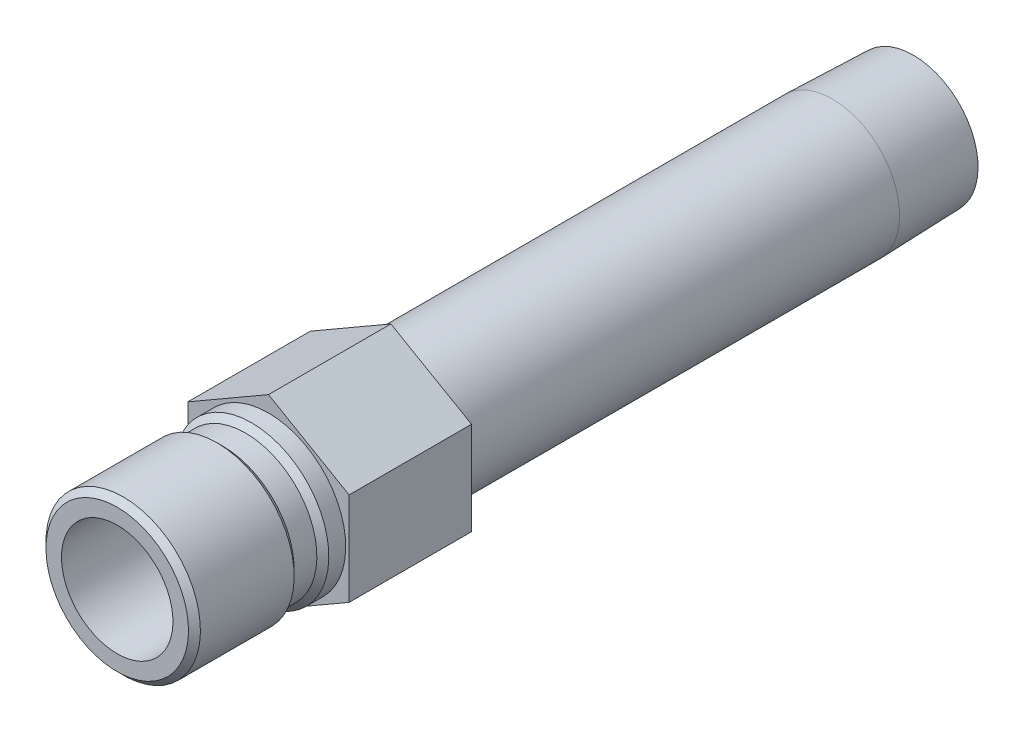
SolidWorks part; units mm, degrees
ref_plane "Front Plane" through (0, 0, 0) normal (0, 0, 1) x (1, 0, 0)
ref_plane "Top Plane" through (0, 0, 0) normal (0, 1, 0) x (1, 0, 0)
ref_plane "Right Plane" through (0, 0, 0) normal (1, 0, 0) x (0, 0, -1)
sketch "Sketch1" plane through (0, 0, 0) normal (1, 0, 0) x (0, 0, -1)
  line L0 (0, 0) -> (-22.479, 0) construction
  line L1 (-19.304, 7.112) -> (-19.304, 9.0932)
  line L2 (-5.8166, 9.0932) -> (-5.8166, 0) construction
  line L3 (-18.542, 9.8552) -> (-6.5786, 9.8552)
  line L4 (0, 8.5725) -> (0, 0) construction
  line L5 (-5.8166, 9.0932) -> (-2.921, 9.0932)
  line L6 (-2.159, 9.8552) -> (0, 9.8552)
  line L7 (0, 9.8552) -> (0, 8.5725)
  line L8 (-5.8166, 9.0932) -> (-6.5786, 9.8552)
  line L9 (-2.921, 9.0932) -> (-2.159, 9.8552)
  line L10 (-19.304, 9.0932) -> (-18.542, 9.8552)
  line L11 (-19.304, 7.112) -> (-1.524, 7.112)
  line L12 (0, 8.5725) -> (71.9582, 8.5725)
  line L13 (71.9582, 8.5725) -> (82.296, 8.2494)
  line L14 (82.296, 8.2494) -> (82.296, 6.2611)
  line L15 (0, 9.8552) -> (15.621, 9.8552) construction
  line L16 (15.621, 9.8552) -> (15.621, 0) construction
  line L17 (15.621, 0) -> (0, 0) construction
  line L18 (-1.0716, 6.2611) -> (-1.524, 7.112)
  line L19 (-1.0716, 6.2611) -> (82.296, 6.2611)
  dimension "D1" = 19.304
  dimension "D2" = 2.8956
  dimension "D3" = 0.762
  dimension "D4" = 45
  dimension "D5" = 13.4874
  dimension "D6" = 45
  dimension "D7" = 1.79
  dimension "D8" = 10.3378
  dimension "D9" = 101.6
  dimension "D10" = 3.175
  dimension "D11" = 34.925
  dimension "D12" = 14.224
  dimension "D13" = 17.145
  dimension "D14" = 19.7104
  dimension "D15" = 12.5222
  dimension "D16" = 118
  dimension "D17" = 17.78
revolve "Revolve1" add sketch "Sketch1" angle 360 about L0
sketch "Sketch2" plane through (0, 0, 0) normal (0, 0, 1) x (1, 0, 0)
  line L1 (-10.287, 5.9392) -> (-10.287, -5.9392)
  line L2 (-10.287, -5.9392) -> (0, -11.8784)
  line L3 (0, -11.8784) -> (10.287, -5.9392)
  line L4 (10.287, -5.9392) -> (10.287, 5.9392)
  line L5 (10.287, 5.9392) -> (0, 11.8784)
  line L6 (0, 11.8784) -> (-10.287, 5.9392)
  circle A0 centre (0, 0) radius 10.287 construction
  circle A1 centre (0, 0) radius 7.112 construction
  circle A2 centre (0, 0) radius 7.112
  dimension "D1" = 20.574
extrude "Boss-Extrude1" add sketch "Sketch2" against normal up to vertex (15.621 mm away) from vertex at 0
